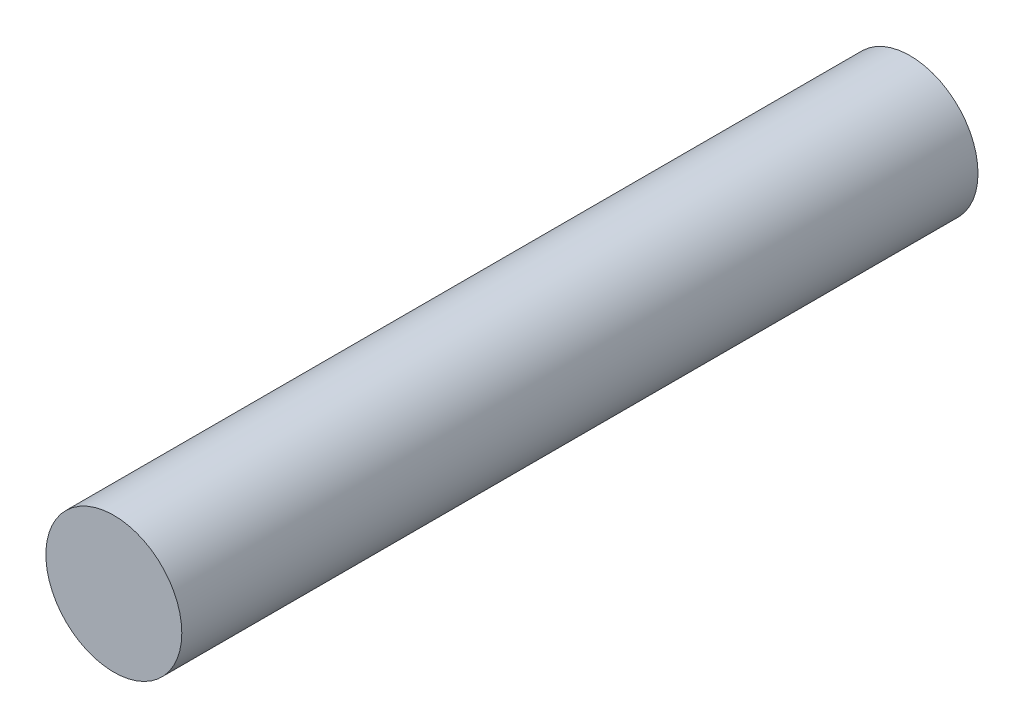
SolidWorks part; units mm, degrees
ref_plane "Front Plane" through (0, 0, 0) normal (0, 0, 1) x (1, 0, 0)
ref_plane "Top Plane" through (0, 0, 0) normal (0, 1, 0) x (1, 0, 0)
ref_plane "Right Plane" through (0, 0, 0) normal (1, 0, 0) x (0, 0, -1)
sketch "Sketch1" plane through (0, 0, 0) normal (0, 0, 1) x (1, 0, 0)
  circle A0 centre (0, 0) radius 7
  dimension "D1" = 14
extrude "Boss-Extrude1" add sketch "Sketch1" along normal blind 82
